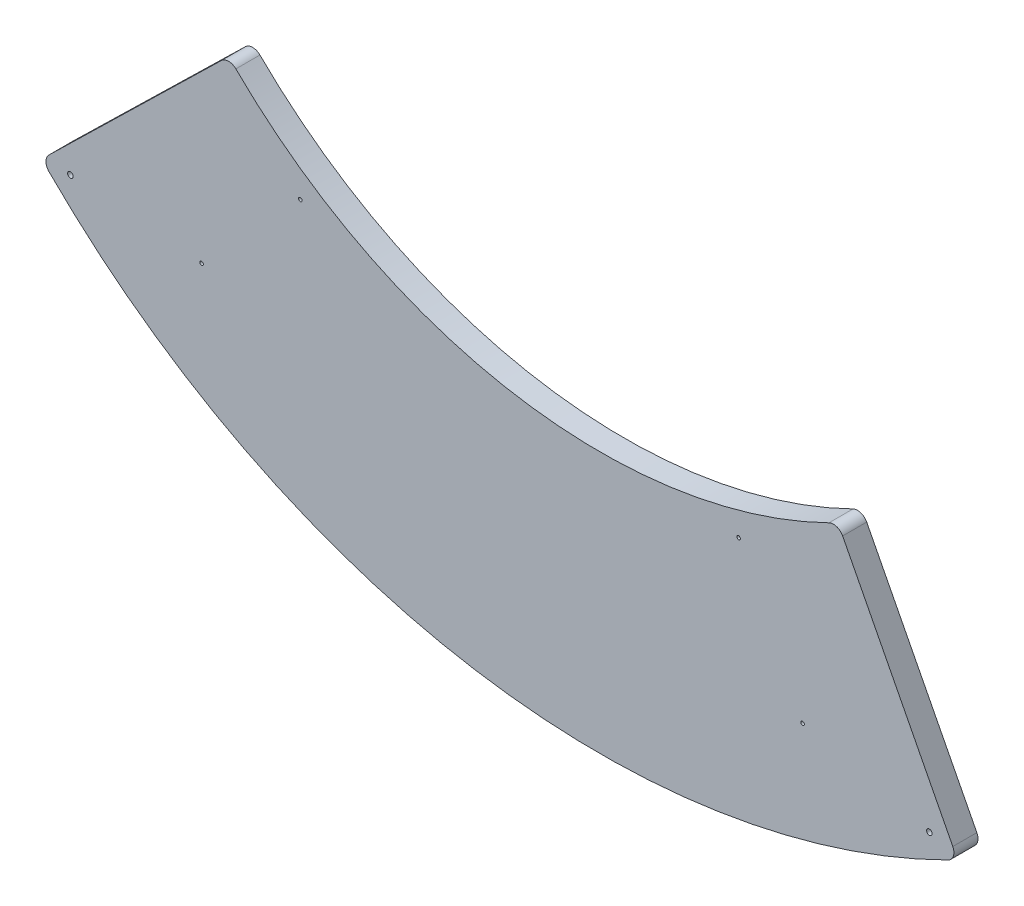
SolidWorks part; units mm, degrees
ref_plane "Plan de face" through (0, 0, 0) normal (0, 0, 1) x (1, 0, 0)
ref_plane "Plan de dessus" through (0, 0, 0) normal (0, 1, 0) x (1, 0, 0)
ref_plane "Plan de droite" through (0, 0, 0) normal (1, 0, 0) x (0, 0, -1)
sketch "Esquisse1" plane through (0, 0, 0) normal (0, 0, 1) x (1, 0, 0)
  line L0 (-542.1153, -500.842) -> (-814.2975, -766.0152)
  line L1 (344.3943, -645.1763) -> (518.4024, -982.9946)
  line L2 (-542.1153, -500.842) -> (615.1994, 626.6706) construction
  line L3 (344.3943, -645.1763) -> (-151.1767, 316.9228) construction
  arc A0 (-542.1153, -500.842) -> (344.3943, -645.1763) centre (-1.3322, 26.0153) ccw
  arc A2 (518.4024, -982.9946) -> (-814.2975, -766.0152) centre (-1.5935, 24.41) cw
  dimension "D1" = 755
  dimension "D2" = 380
  dimension "D3" = 73
  dimension "D4" = 380
extrude "Extrusion1" add sketch "Esquisse1" along normal blind 35
sketch "Esquisse4" plane through (0, 0, 0) normal (0, 0, -1) x (-1, 0, 0)
  circle A0 centre (-199.795, -736.2109) radius 2.6
  circle A1 centre (-292.8912, -923.6065) radius 2.6
  circle A2 centre (437.929, -629.0975) radius 2.6
  circle A3 centre (581.5943, -781.2299) radius 2.6
extrude "Enlèv. mat.-Extru.3" cut sketch "Esquisse4" against normal through all
fillet "Congé1" radius 15 4 edges at (-814.2975, -766.0152, 17.5) (-542.1153, -500.842, 17.5) (518.4024, -982.9946, 17.5) (344.3943, -645.1763, 17.5)
sketch "Esquisse5" plane through (0, 0, 35) normal (0, 0, 1) x (1, 0, 0)
  circle A0 centre (-772.5649, -765.2626) radius 4
  circle A1 centre (477.4022, -968.5538) radius 4
extrude "Enlèv. mat.-Extru.4" cut sketch "Esquisse5" against normal through all
